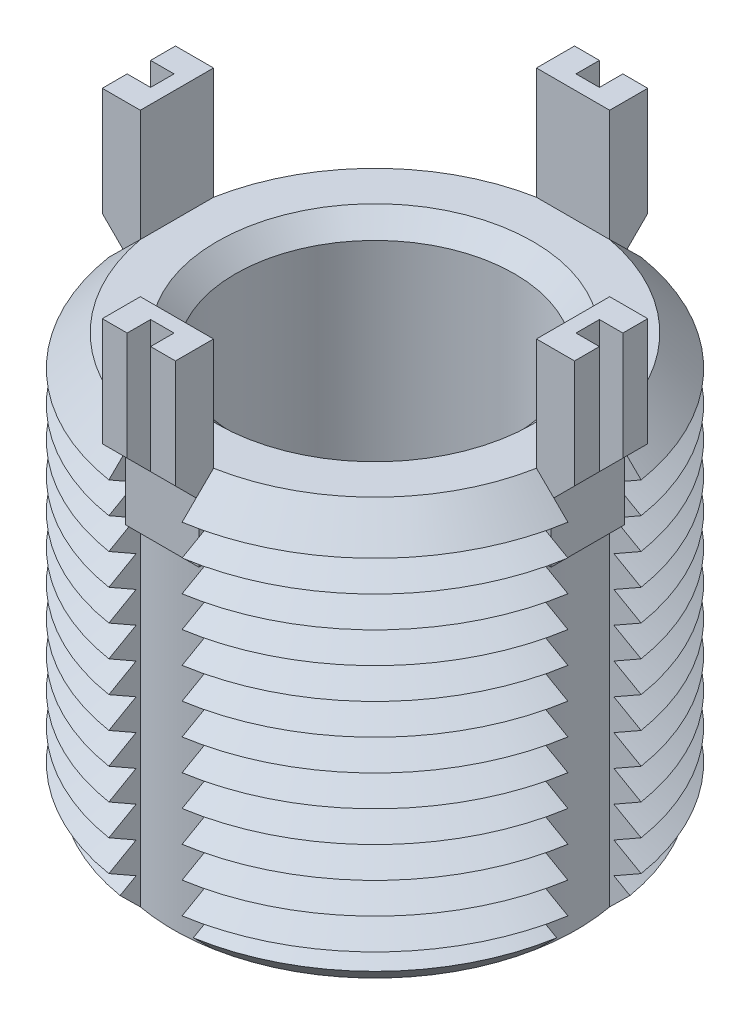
SolidWorks part; units mm, degrees
ref_plane "Front Plane" through (0, 0, 0) normal (0, 0, 1) x (1, 0, 0)
ref_plane "Top Plane" through (0, 0, 0) normal (0, 1, 0) x (1, 0, 0)
ref_plane "Right Plane" through (0, 0, 0) normal (1, 0, 0) x (0, 0, -1)
sketch "Sketch1" plane through (0, 0, 0) normal (0, 1, 0) x (1, 0, 0)
  circle A0 centre (0, 0) radius 15.875
  dimension "D1" = 31.75
extrude "Boss-Extrude1" add sketch "Sketch1" against normal blind 28.448
chamfer "Chamfer1" distance 2.117 angle 45 2 edges at (0, -28.448, 15.875) (0, 0, 15.875)
sketch "Sketch2" plane through (0, 0, 0) normal (1, 0, 0) x (0, 0, -1)
  line L0 (0, 0.8859) -> (0, -9.2617) construction
sketch "Sketch3" plane through (0, 0, 0) normal (1, 0, 0) x (0, 0, -1)
  line L0 (-15.875, -2.117) -> (-14.0416, -3.1755)
  line L1 (-14.0416, -3.1755) -> (-15.875, -4.234)
  line L2 (-15.875, -2.117) -> (-15.875, -26.331) construction
  line L3 (-15.875, -4.234) -> (-15.875, -2.117)
  dimension "D1" = 2.117
revolve "Cut-Revolve1" cut sketch "Sketch3" angle 360 about L0
pattern_linear "LPattern1" count 12 spacing 2.117 along (0, -1, 0) of "Cut-Revolve1"
sketch "Sketch4" plane through (0, 0, 0) normal (0, 1, 0) x (1, 0, 0)
  line L0 (-13.529, 2.5) -> (-15.6769, 2.5)
  line L2 (-15.6769, -2.5) -> (-13.529, -2.5)
  arc A0 (-13.529, 2.5) -> (-13.529, -2.5) centre (0, 0) ccw
  arc A1 (-15.6769, 2.5) -> (-15.6769, -2.5) centre (0, 0) ccw
  circle A2 centre (0, 0) radius 15.875 construction
  circle A3 centre (0, 0) radius 13.758 construction
  point P1 (-13.758, 0)
  point P3 (-15.875, 0)
  point P13 (0, 0)
  dimension "D1" = 5
extrude "Cut-Extrude1" cut sketch "Sketch4" against normal up to surface (28.448 mm away)
pattern_circular "CirPattern1" count 4 over 360 about axis through (0, 0, 0) along (0, 1, 0) of "Cut-Extrude1"
sketch "Sketch5" plane through (0, 0, 0) normal (1, 0, 0) x (0, 0, -1)
  line L0 (-13.529, 7.649) -> (-13.529, -5.351)
  line L1 (-13.529, -5.351) -> (-14.529, -5.351)
  line L2 (-14.529, -5.351) -> (-14.529, -1.351)
  line L3 (-14.529, -1.351) -> (-16.129, 0.249)
  line L4 (-16.129, 0.249) -> (-16.129, 7.649)
  line L5 (-16.129, 7.649) -> (-13.529, 7.649)
  line L6 (-15.6769, -6.351) -> (-2.5, -6.351) construction
  point P9 (-2.5, 0)
  point P10 (-14.529, -1.351)
  dimension "D1" = 1
  dimension "D2" = 13
  dimension "D3" = 9
  dimension "D4" = 2.6
  dimension "D5" = 1
  dimension "D6" = 45
extrude "Boss-Extrude3" add sketch "Sketch5" along normal mid plane 5
pattern_circular "CirPattern2" count 4 over 360 about axis through (0, 0, 0) along (0, 1, 0) of "Boss-Extrude3"
sketch "Sketch6" plane through (0, 7.649, 0) normal (0, 1, 0) x (1, 0, 0)
  line L0 (-16.129, -2.5) -> (-16.129, 2.5) construction
  line L1 (-16.129, -0.8) -> (-14.529, -0.8)
  line L2 (-16.129, -0.8) -> (-16.129, 0.8)
  line L3 (-16.129, 0.8) -> (-14.529, 0.8)
  line L4 (-14.529, -0.8) -> (-14.529, 0.8)
  line L5 (-16.129, -0.8) -> (-14.529, 0.8) construction
  line L6 (-16.129, 0.8) -> (-14.529, -0.8) construction
  line L7 (16.129, 2.5) -> (16.129, -2.5) construction
  line L8 (-0.8, 14.529) -> (0.8, 14.529)
  line L9 (-0.8, 14.529) -> (-0.8, 16.129)
  line L10 (-0.8, 16.129) -> (0.8, 16.129)
  line L11 (0.8, 14.529) -> (0.8, 16.129)
  line L12 (-0.8, 14.529) -> (0.8, 16.129) construction
  line L13 (-0.8, 16.129) -> (0.8, 14.529) construction
  line L14 (14.529, -0.8) -> (16.129, -0.8)
  line L15 (14.529, -0.8) -> (14.529, 0.8)
  line L16 (14.529, 0.8) -> (16.129, 0.8)
  line L17 (16.129, -0.8) -> (16.129, 0.8)
  line L18 (14.529, -0.8) -> (16.129, 0.8) construction
  line L19 (14.529, 0.8) -> (16.129, -0.8) construction
  line L20 (-0.8, -16.129) -> (0.8, -16.129)
  line L21 (-0.8, -16.129) -> (-0.8, -14.529)
  line L22 (-0.8, -14.529) -> (0.8, -14.529)
  line L23 (0.8, -16.129) -> (0.8, -14.529)
  line L24 (-0.8, -16.129) -> (0.8, -14.529) construction
  line L25 (-0.8, -14.529) -> (0.8, -16.129) construction
  line L26 (-2.5, 16.129) -> (2.5, 16.129) construction
  line L27 (2.5, -16.129) -> (-2.5, -16.129) construction
  point P0 (-15.329, 0)
  point P7 (-16.129, 0)
  point P8 (-16.129, 0)
  point P9 (0, 15.329)
  point P14 (15.329, 0)
  point P19 (0, -15.329)
  point P24 (0, 16.129)
  point P25 (16.129, 0)
  point P26 (16.129, 0)
  point P27 (0, 16.129)
  point P30 (0, -16.129)
  point P33 (0, -16.129)
  dimension "D1" = 1.6
  dimension "D2" = 1.6
extrude "Cut-Extrude3" cut sketch "Sketch6" against normal through all both and the other way through all
sketch "Sketch7" plane through (0, 0, 0) normal (0, 1, 0) x (1, 0, 0)
  circle A0 centre (0, 0) radius 9.525
  dimension "D1" = 19.05
extrude "Cut-Extrude4" cut sketch "Sketch7" against normal up to surface (28.448 mm away)
chamfer "Chamfer2" distance 1.27 angle 45 2 edges at (0, 0, 9.525) (0, -28.448, 9.525)
